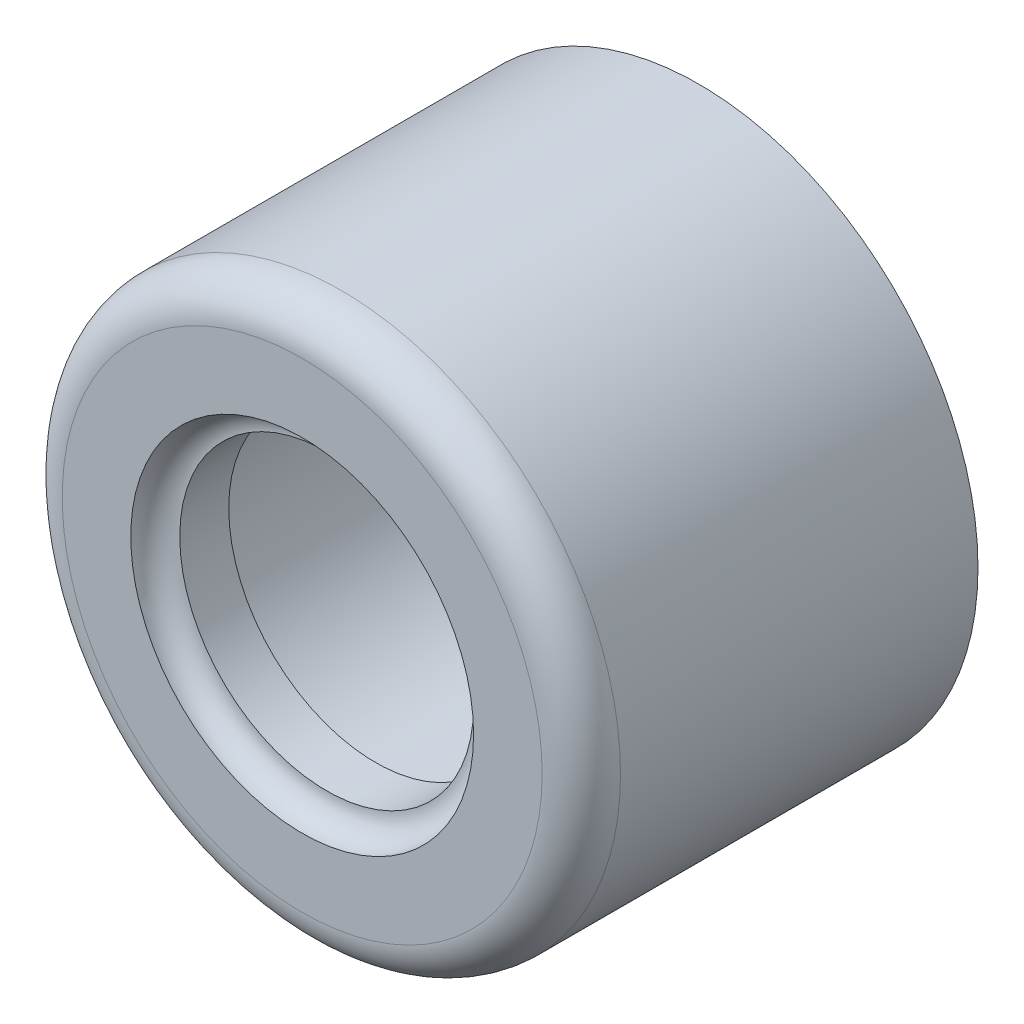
SolidWorks part; units mm, degrees
ref_plane "Face" through (0, 0, 0) normal (0, 0, 1) x (1, 0, 0)
ref_plane "Dessus" through (0, 0, 0) normal (0, 1, 0) x (1, 0, 0)
ref_plane "Droite" through (0, 0, 0) normal (1, 0, 0) x (0, 0, -1)
sketch "Esquisse1" plane through (0, 0, 0) normal (0, 0, 1) x (1, 0, 0)
  circle A0 centre (0, 0) radius 28.5
  dimension "D1" = 57
extrude "Base-Extrusion" add sketch "Esquisse1" along normal blind 40.5
fillet "Congé1" radius 4
sketch "Esquisse2" plane through (0, 0, 40.5) normal (0, 0, 1) x (1, 0, 0)
  circle A0 centre (0, 0) radius 17.5
  dimension "D1" = 35
extrude "Enlèv. mat.-Extru.1" cut sketch "Esquisse2" against normal blind 2.5
fillet "Congé2" radius 2.5
hole_wizard "Perçage1" positions "Esquisse4" profile "Esquisse3" legacy
sketch "Esquisse4" plane through (0, 0, 0) normal (0, 0, -1) x (-1, 0, 0)
  point P0 (0, 23)
  dimension "D1" = 23
sketch "Esquisse3" plane through (0, 23, 0) normal (1, 0, 0) x (0, 1, 0)
  line L0 (0, 0) -> (0, 21.8026)
  line L1 (0, 21.8026) -> (3, 20)
  line L2 (3, 20) -> (3, 0)
  line L4 (3, 0) -> (0, 0)
  line L6 (0, 21.8026) -> (-3, 20) construction
  line L7 (0, -4.2442) -> (0, 117.3081) construction
  dimension "Diamètre" = 6
  dimension "Profondeur" = 20
  dimension "Angle" = 118
hole_wizard "Trou taraudé M6x1.01" positions "Esquisse6" profile "Esquisse5" tap size "M6x1.0" standard "ISO"
sketch "Esquisse6" plane through (0, 0, 0) normal (0, 0, -1) x (-1, 0, 0)
  point P0 (-23, 0)
  dimension "D1" = 23
sketch "Esquisse5" plane through (23, 0, 0) normal (1, 0, 0) x (0, 1, 0)
  line L0 (0, 0) -> (0, 21.5022)
  line L1 (0, 21.5022) -> (2.5, 20)
  line L2 (2.5, 20) -> (2.5, 0)
  line L5 (2.5, 0) -> (0, 0)
  line L10 (0, 21.5022) -> (-2.5, 20) construction
  line L11 (0, -6.35) -> (0, 107.95) construction
  dimension "Diamètre du perçage" = 5
  dimension "Profondeur du perçage" = 20
  dimension "Angle de pointe" = 118
pattern_circular "Répétition circulaire1" count 2 every 180
pattern_circular "Répétition circulaire2" count 2 every 180
sketch "Esquisse7" plane through (0, 0, 0) normal (0, 0, -1) x (-1, 0, 0)
  circle A0 centre (0, 0) radius 15
  dimension "D1" = 30
extrude "Enlèv. mat.-Extru.2" cut sketch "Esquisse7" against normal through all
sketch "Esquisse8" plane through (0, 0, 0) normal (0, 0, -1) x (-1, 0, 0)
  circle A0 centre (0, 0) radius 17.5
  dimension "D1" = 35
extrude "Enlèv. mat.-Extru.3" cut sketch "Esquisse8" against normal blind 33
